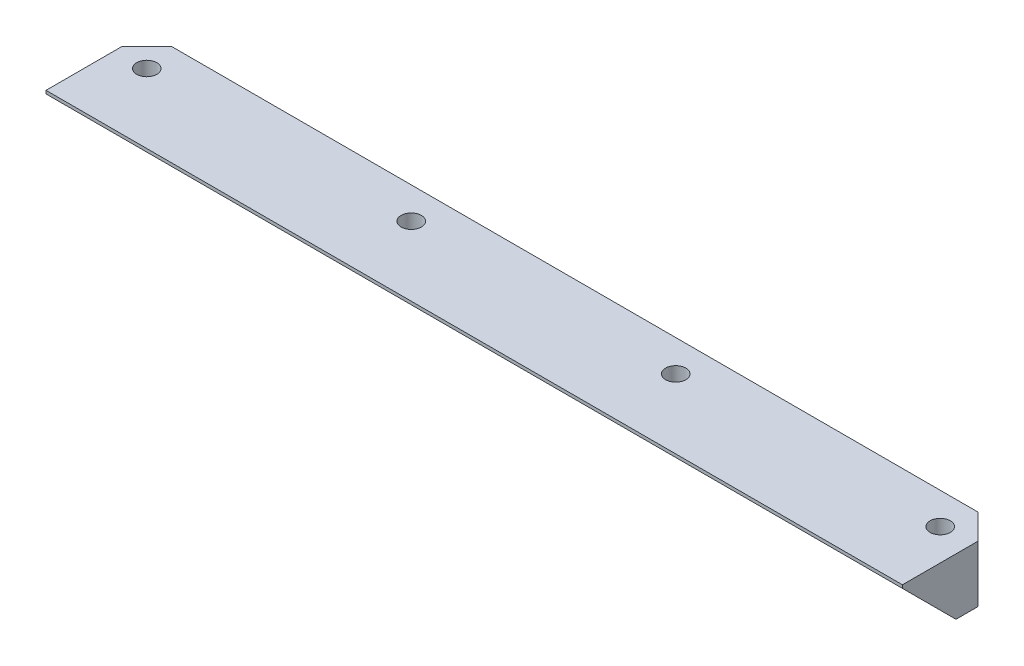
SolidWorks part; units mm, degrees
ref_plane "Front Plane" through (0, 0, 0) normal (0, 0, 1) x (1, 0, 0)
ref_plane "Top Plane" through (0, 0, 0) normal (0, 1, 0) x (1, 0, 0)
ref_plane "Right Plane" through (0, 0, 0) normal (1, 0, 0) x (0, 0, -1)
sketch "Sketch1" plane through (0, 0, 0) normal (1, 0, 0) x (0, 0, -1)
  line L0 (0, 0) -> (-11.9063, 0)
  line L1 (-11.9063, 0) -> (-25.4, 13.4938)
  line L2 (-25.4, 14.2875) -> (0, 14.2875)
  line L3 (0, 14.2875) -> (0, 0)
  line L4 (-25.4, 14.2875) -> (-25.4, 13.4938)
  dimension "D1" = 14.2875
  dimension "D2" = 45
  dimension "D3" = 25.4
  dimension "D4" = 0.7937
extrude "Boss-Extrude1" add sketch "Sketch1" along normal mid plane 215.9
chamfer "Chamfer1" distance 6.35 angle 45 2 edges at (-107.95, 7.1437, 0) (107.95, 7.1437, 0)
sketch "Sketch2" plane through (0, 14.2875, 0) normal (0, 1, 0) x (1, 0, 0)
  line L0 (100.0125, -7.9375) -> (-100.0125, -7.9375) construction
  line L1 (33.3375, -7.9375) -> (-33.3375, -7.9375) construction
  line L2 (101.6, 0) -> (-101.6, 0) construction
  line L3 (0, 0) -> (0, -7.9375) construction
  line L5 (-100.0125, -7.9375) -> (-33.3375, -7.9375) construction
  point P2 (-100.0125, -7.9375)
  point P3 (-33.3375, -7.9375)
  point P4 (33.3375, -7.9375)
  point P5 (100.0125, -7.9375)
  dimension "D1" = 7.9375
  dimension "D3" = 66.675
hole_wizard "1/4-20 Tapped Hole1" positions "Sketch4" profile "Sketch3" tap size "1/4-20" standard "ANSI Inch"
sketch "Sketch4" plane through (0, 14.2875, 0) normal (0, 1, 0) x (1, 0, 0)
  point P0 (-100.0125, -7.9375)
  point P2 (-33.3375, -7.9375)
  point P5 (33.3375, -7.9375)
  point P8 (100.0125, -7.9375)
sketch "Sketch3" plane through (-100.0125, 14.2875, 7.9375) normal (1, 0, 0) x (0, 0, 1)
  line L0 (0, 0) -> (0, 14.2875)
  line L1 (0, 14.2875) -> (2.5527, 14.2875)
  line L2 (2.5527, 14.2875) -> (2.5527, 0)
  line L5 (2.5527, 0) -> (0, 0)
  line L11 (0, -6.35) -> (0, 107.95) construction
  dimension "Thru Tap Drill Dia." = 5.1054
  dimension "Thru Tap Drill Depth" = 14.2875
